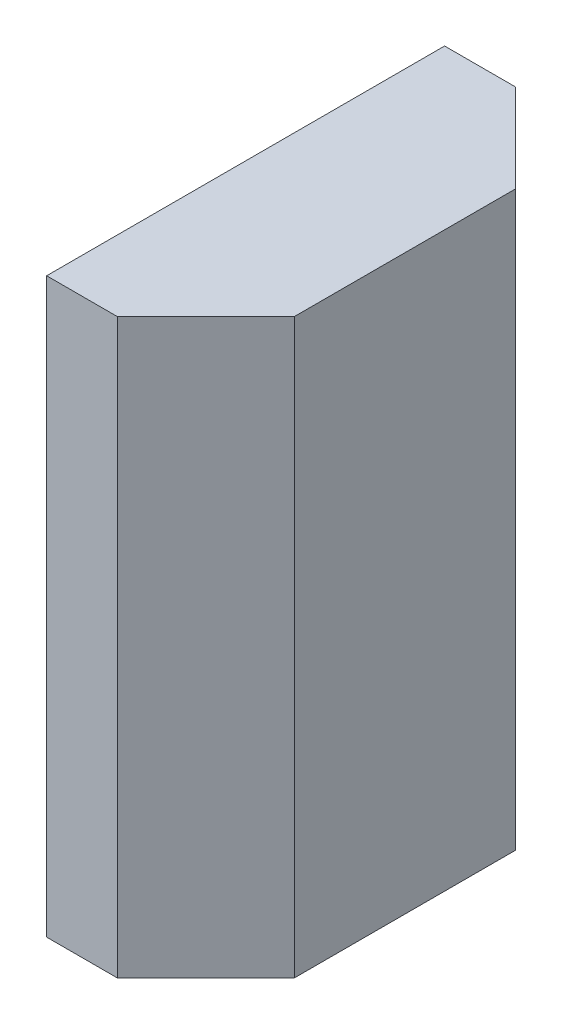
SolidWorks part; units mm, degrees
other "Chamfer6"
ref_plane "Front Plane" through (0, 0, 0) normal (0, 0, 1) x (1, 0, 0)
ref_plane "Top Plane" through (0, 0, 0) normal (0, 1, 0) x (1, 0, 0)
ref_plane "Right Plane" through (0, 0, 0) normal (1, 0, 0) x (0, 0, -1)
imported_body "Imported1"
sketch "Sketch1" plane through (0, 0, 0) normal (0, 1, 0) x (1, 0, 0)
  line L0 (6.35, -22.5) -> (14.35, -22.5)
  line L1 (14.35, -22.5) -> (24.35, -12.5)
  line L2 (24.35, -12.5) -> (24.35, 12.5)
  line L3 (24.35, 12.5) -> (14.35, 22.5)
  line L4 (14.35, 22.5) -> (6.35, 22.5)
  line L6 (6.35, 22.5) -> (6.35, -22.5)
extrude "Boss-Extrude1" add sketch "Sketch1" against normal blind 33.02
